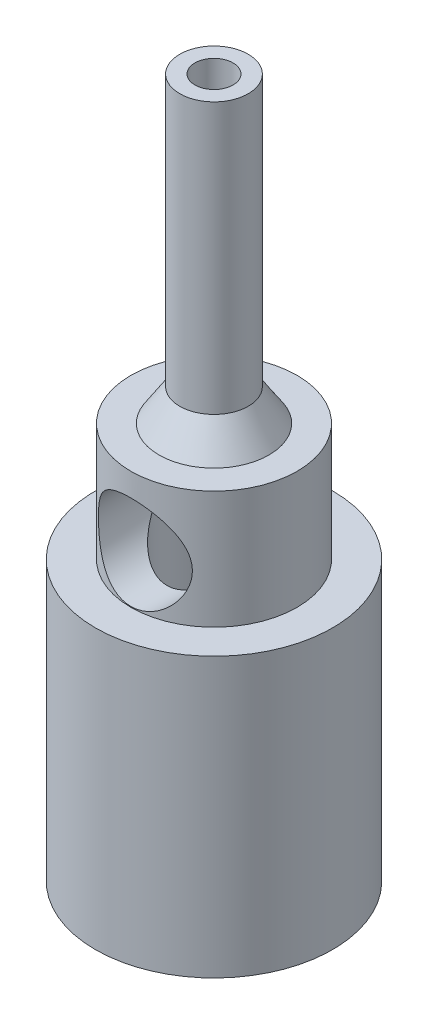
SolidWorks part; units mm, degrees
ref_plane "Plan de face" through (0, 0, 0) normal (0, 0, 1) x (1, 0, 0)
ref_plane "Plan de dessus" through (0, 0, 0) normal (0, 1, 0) x (1, 0, 0)
ref_plane "Plan de droite" through (0, 0, 0) normal (1, 0, 0) x (0, 0, -1)
sketch "Esquisse1" plane through (0, 0, 0) normal (0, 0, 1) x (1, 0, 0)
  line L0 (0, 37.9536) -> (0, -13.3771) construction
  line L1 (1.2, 22.5) -> (1.2, 43.9)
  line L2 (1.2, 43.9) -> (2.15, 43.9)
  line L3 (2.15, 43.9) -> (2.15, 26.9)
  line L4 (2.15, 26.9) -> (3.45, 24.9)
  line L5 (3.45, 24.9) -> (5.22, 24.9)
  line L6 (5.22, 24.9) -> (5.22, 17.5)
  line L7 (5.22, 17.5) -> (7.45, 17.5)
  line L8 (7.45, 17.5) -> (7.45, 0)
  line L9 (4.15, 0.7) -> (6.1, 0.7)
  line L10 (6.1, 0.7) -> (6.1, 0)
  line L11 (6.1, 0) -> (7.45, 0)
  line L12 (2.95, 0) -> (2.95, 23.5)
  line L13 (2.95, 0) -> (3.45, 0)
  line L14 (3.45, 0) -> (4.15, 0.7)
  line L15 (2.95, 23.5) -> (2.15, 23.5)
  line L16 (2.15, 23.5) -> (2.15, 22.5)
  line L17 (2.15, 22.5) -> (1.2, 22.5)
  dimension "D2" = 2.4
  dimension "D3" = 4.3
  dimension "D4" = 17
  dimension "D5" = 6.9
  dimension "D6" = 19
  dimension "D7" = 10.44
  dimension "D8" = 7.4
  dimension "D9" = 14.9
  dimension "D10" = 12.2
  dimension "D11" = 0.7
  dimension "D12" = 5.9
  dimension "D13" = 23.5
  dimension "D14" = 1
  dimension "D15" = 4.3
  dimension "D16" = 135
revolve "Révolution1" add sketch "Esquisse1" angle 360 about L0
sketch "Esquisse2" plane through (0, 0, 0) normal (0, 0, 1) x (1, 0, 0)
  line L0 (7.45, 17.5) -> (-7.45, 17.5) construction
  line L1 (0, 20.5) -> (0, 0) construction
  circle A0 centre (0, 20.5) radius 2.95
  dimension "D1" = 5.9
  dimension "D2" = 3
extrude "Enlèv. mat.-Extru.1" cut sketch "Esquisse2" against normal mid plane 20
sketch "Esquisse3" plane through (0, 0, 0) normal (0, 0, 1) x (1, 0, 0)
  line L0 (1.2, 23.1949) -> (1.2, 43.9) construction
  line L1 (1.2, 23.8066) -> (2.15, 23.8066)
  line L2 (1.2, 23.8066) -> (1.2, 22.8366)
  line L3 (1.2, 22.8366) -> (2.15, 22.8366)
  line L4 (2.15, 23.8066) -> (2.15, 22.8366)
  line L5 (2.15, 22.5199) -> (2.15, 23.5) construction
  line L6 (0, 23.45) -> (0, 23.0599) construction
  circle A0 centre (0, 20.5) radius 2.95 construction
revolve "Révolution2" add sketch "Esquisse3" angle 360 about L6
sketch "Esquisse4" plane through (0, 0, 0) normal (0, 0, 1) x (1, 0, 0)
  line L0 (-1.8008, 22.8366) -> (1.8008, 22.8366) construction
  line L1 (1.0623, 22.8366) -> (2.3172, 22.8366)
  line L2 (1.0623, 22.8366) -> (1.0623, 22.444)
  line L3 (1.0623, 22.444) -> (2.3172, 22.444)
  line L4 (2.3172, 22.8366) -> (2.3172, 22.444)
  line L5 (0, 22.8366) -> (0, 23.2138) construction
revolve "Enlèvement de matière-Révolution1" cut sketch "Esquisse4" angle 360 about L5
